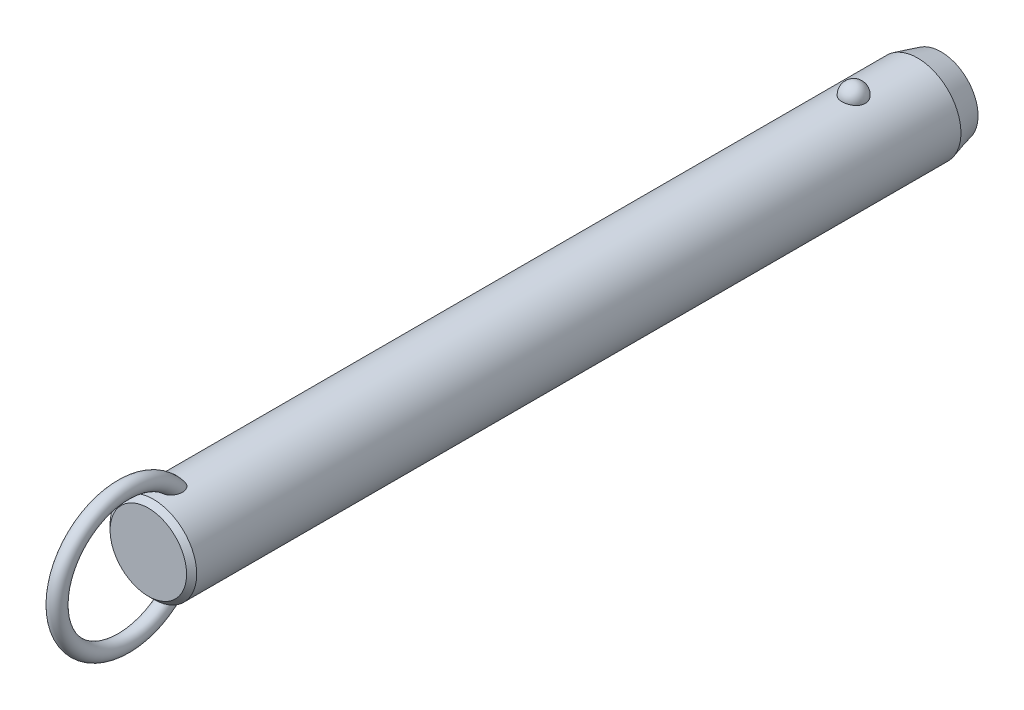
SolidWorks part; units mm, degrees
ref_plane "Front Plane" through (0, 0, 0) normal (0, 0, 1) x (1, 0, 0)
ref_plane "Top Plane" through (0, 0, 0) normal (0, 1, 0) x (1, 0, 0)
ref_plane "Right Plane" through (0, 0, 0) normal (1, 0, 0) x (0, 0, -1)
sketch "Sketch2" plane through (0, 0, 0) normal (0, 0, 1) x (1, 0, 0)
  circle A0 centre (0, 0) radius 11.1
  point P3 (0, 11.1)
  dimension "D1" = 22.2
extrude "Boss-Extrude1" add sketch "Sketch2" along normal blind 165.1
sketch "Sketch3" plane through (0, 0, 0) normal (0, 0, -1) x (-1, 0, 0)
  circle A0 centre (0, 0) radius 11.1
  dimension "D1" = 22.2
extrude "Boss-Extrude2" add sketch "Sketch3" along normal blind 25.4
chamfer "Chamfer1" distance 6 angle 15 1 edges at (-11.1, 0, -25.4)
sketch "Sketch12" plane through (0, 0, 0) normal (1, 0, 0) x (0, 0, -1)
  line L0 (-165.1, 11.1) -> (-165.1, -11.1) construction
  point P0 (-165.1, 0)
sketch "Sketch13" plane through (0, 0, 0) normal (1, 0, 0) x (0, 0, -1)
  circle A0 centre (-184.15, 0) radius 19.05
  point P2 (-165.1, 0)
  dimension "D1" = 38.1
sketch "Sketch14" plane through (0, 0, 0) normal (0, 1, 0) x (1, 0, 0)
  circle A0 centre (0, -167.1) radius 2
  point P2 (0, -165.1)
  dimension "D1" = 4
sweep "Sweep1" add profiles "Sketch14" path "Sketch13"
sketch "Sketch15" plane through (0, 0, 165.1) normal (0, 0, 1) x (1, 0, 0)
  circle A0 centre (0, 0) radius 11.1
  dimension "D1" = 22.2
extrude "Boss-Extrude3" add sketch "Sketch15" along normal blind 12.7
chamfer "Chamfer2" distance 1.3 angle 45 1 edges at (11.1, 0, 177.8)
sketch "Sketch18" plane through (0, 0, 0) normal (1, 0, 0) x (0, 0, -1)
  line L0 (19.4, 11.1) -> (-168.668, 11.1) construction
  line L1 (3, 14.1) -> (3, 8.1)
  line L2 (-168.668, -11.1) -> (19.4, -11.1) construction
  arc A0 (3, 14.1) -> (3, 8.1) centre (3, 11.1) ccw
  point P4 (0, 11.1)
  dimension "D1" = 25.2
revolve "Revolve1" add sketch "Sketch18" angle 360 about L1
